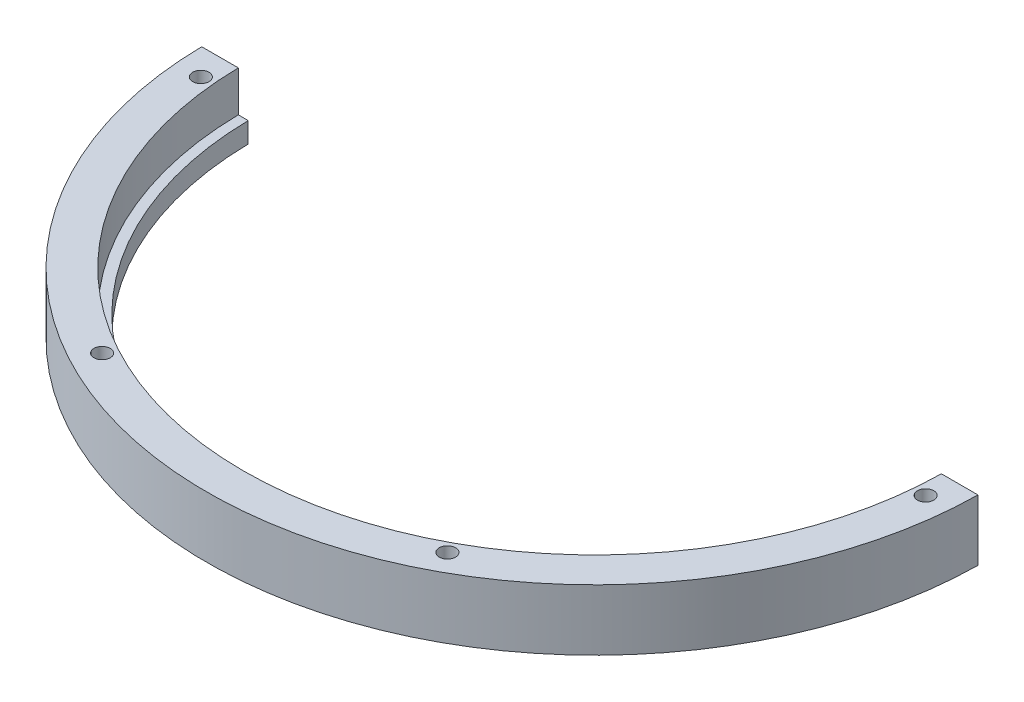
SolidWorks part; units mm, degrees
ref_plane "Front Plane" through (0, 0, 0) normal (0, 0, 1) x (1, 0, 0)
ref_plane "Top Plane" through (0, 0, 0) normal (0, 1, 0) x (1, 0, 0)
ref_plane "Right Plane" through (0, 0, 0) normal (1, 0, 0) x (0, 0, -1)
sketch "Sketch1" plane through (0, 0, 0) normal (0, 0, 1) x (1, 0, 0)
  line L0 (0, 0) -> (0, 51.4902) construction
  line L1 (-121.2215, 6.35) -> (-106.6927, 6.35)
  line L2 (-121.2215, 6.35) -> (-121.2215, 25.4)
  line L3 (-121.2215, 25.4) -> (-109.7915, 25.4)
  line L4 (-109.7915, 25.4) -> (-109.7915, 12.7)
  line L5 (-109.7915, 12.7) -> (-106.6927, 12.7)
  line L6 (-106.6927, 12.7) -> (-106.6927, 6.35)
  line L7 (-109.5375, 25.4) -> (-109.5375, -812.8) construction
  line L12 (-121.2215, 25.4) -> (121.2215, 25.4) construction
  line L14 (-106.4387, 12.7) -> (-106.4387, -800.1) construction
  line L15 (-109.5375, 12.7) -> (-106.4387, 12.7) construction
  dimension "D1" = 0.254
  dimension "D2" = 6.35
  dimension "D3" = 0.254
  dimension "D4" = 11.43
revolve "Revolve1" add sketch "Sketch1" angle 180 about L0
hole_wizard " Tapped Hole1" positions "Sketch3" profile "Sketch2" tap size "1/4-20" standard "ANSI Inch"
sketch "Sketch3" plane through (0, 25.4, 0) normal (0, 1, 0) x (-1, 0, 0)
  line L2 (0, 0) -> (-113.1692, 9.901) construction
  line L4 (0, 0) -> (-53.9153, 99.9922) construction
  line L6 (0, 0) -> (0, 98.4227) construction
  line L8 (0, 0) -> (-75.0177, 0) construction
  line L10 (0, 0) -> (53.9153, 99.9922) construction
  line L14 (-121.2215, 0) -> (-106.6927, 0) construction
  line L15 (121.2215, 0) -> (106.6927, 0) construction
  line L16 (-109.7915, 0) -> (-121.2215, 0) construction
  arc A1 (113.6015, 0) -> (-113.6015, 0) centre (0, 0) ccw construction
  arc A2 (109.7915, 0) -> (-109.7915, 0) centre (0, 0) ccw construction
  point P0 (-113.1692, 9.901)
  point P2 (-53.9153, 99.9922)
  point P37 (113.1692, 9.901)
  point P38 (53.9153, 99.9922)
  dimension "D4" = 3.81
  dimension "D1" = 5
  dimension "D2" = 56.667
  dimension "D3" = 56.667
sketch "Sketch2" plane through (113.1692, 25.4, 9.901) normal (1, 0, 0) x (0, 0, 1)
  line L0 (0, 0) -> (0, 19.05)
  line L1 (0, 19.05) -> (2.5527, 19.05)
  line L2 (2.5527, 19.05) -> (2.5527, 0)
  line L5 (2.5527, 0) -> (0, 0)
  line L11 (0, -6.35) -> (0, 107.95) construction
  dimension "Thread Major Dia." = 5.1054
  dimension "Thru Tap Drill Depth" = 19.05
sketch "Sketch4" plane through (0, 25.4, 0) normal (0, 1, 0) x (1, 0, 0)
  line L0 (-109.7915, 0) -> (-121.2215, 0) construction
  line L1 (-136.8404, 22.6057) -> (128.0755, 22.6057)
  line L2 (-136.8404, 22.6057) -> (-136.8404, -1.5875)
  line L3 (-136.8404, -1.5875) -> (128.0755, -1.5875)
  line L4 (128.0755, 22.6057) -> (128.0755, -1.5875)
  dimension "D1" = 1.5875
extrude "Cut-Extrude1" cut sketch "Sketch4" against normal through all
sketch "Sketch5" [suppressed] plane through (0, 18.796, 0) normal (0, 1, 0) x (1, 0, 0)
  line L0 (0, 0) -> (0, -252.6615) construction
  line L1 (-118.3465, -11.8223) -> (-102.6184, -169.2676)
  line L2 (-52.07, -215.018) -> (52.07, -215.018)
  line L3 (118.3465, -11.8223) -> (102.6184, -169.2676)
  circle A0 centre (-52.07, -164.218) radius 50.8 construction
  arc A1 (-118.9249, -1.5875) -> (118.9249, -1.5875) centre (0, 0) ccw construction
  arc A2 (-118.3465, -11.8223) -> (118.3465, -11.8223) centre (0, 0) ccw
  arc A3 (-102.6184, -169.2676) -> (-52.07, -215.018) centre (-52.07, -164.218) ccw
  arc A4 (102.6184, -169.2676) -> (52.07, -215.018) centre (52.07, -164.218) cw
  point P16 (0, -215.018)
  dimension "D1" = 101.6
  dimension "D2" = 1.27
  dimension "D3" = 2.54
extrude "Boss-Extrude1" [suppressed] add sketch "Sketch5" against normal up to surface (18.288 mm away)
sketch "Sketch6" [suppressed] plane through (0, 0.508, 0) normal (0, -1, 0) x (1, 0, 0)
  line L0 (0, 0) -> (0, 222.0268) construction
  line L1 (0, 0) -> (0, 252.6615) construction
  circle A0 centre (-52.07, 164.218) radius 31.75
  circle A1 centre (52.07, 164.218) radius 31.75
  dimension "D1" = 63.5
extrude "Boss-Extrude2" [suppressed] add sketch "Sketch6" along normal blind 25.4
ref_plane "Plane2" [suppressed] through (0, 0, 164.218) normal (0, 0, -1) x (-1, 0, 0)
sketch "Sketch11" [suppressed] plane through (0, -24.892, 0) normal (0, -1, 0) x (1, 0, 0)
  circle A0 centre (-52.07, 164.218) radius 22.6228
  dimension "D1" = 45.2456
sketch "Sketch12" [suppressed] plane through (0, 0.508, 0) normal (0, -1, 0) x (1, 0, 0)
  circle A0 centre (-39.333, 165.7705) radius 6.0959
  dimension "D1" = 12.1918
loft "Cut-Loft1" [suppressed] cut profiles "Sketch12", "Sketch11"
mirror "Mirror2" [suppressed] about plane through (0, 0, 0) normal (1, 0, 0)
